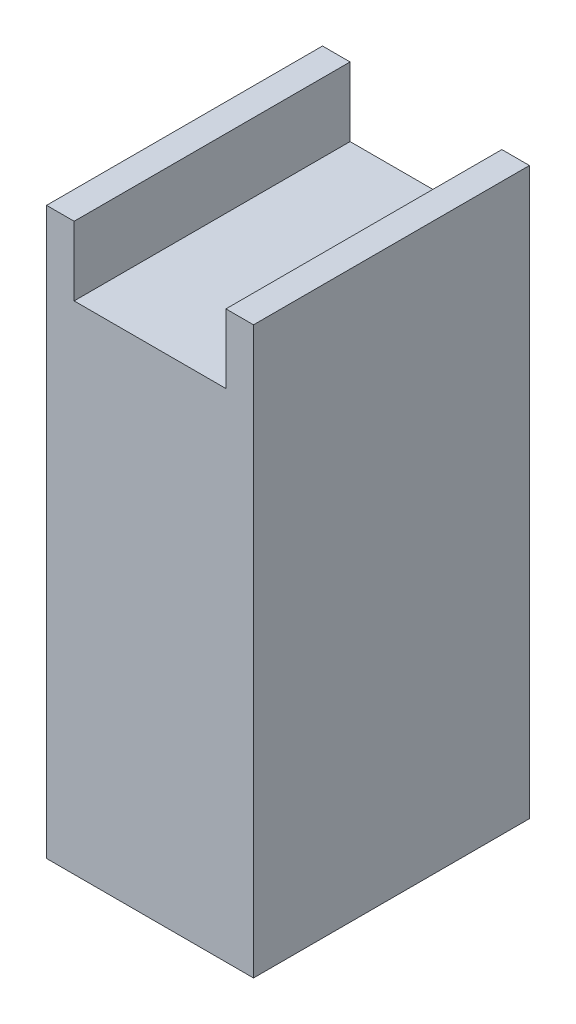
SolidWorks part; units mm, degrees
ref_plane "Front Plane" through (0, 0, 0) normal (0, 0, 1) x (1, 0, 0)
ref_plane "Top Plane" through (0, 0, 0) normal (0, 1, 0) x (1, 0, 0)
ref_plane "Right Plane" through (0, 0, 0) normal (1, 0, 0) x (0, 0, -1)
sketch "Sketch1" plane through (0, 0, 0) normal (0, 0, 1) x (1, 0, 0)
  line L0 (-9.525, 0) -> (-9.525, 52.07)
  line L1 (-9.525, 52.07) -> (-6.985, 52.07)
  line L2 (-6.985, 52.07) -> (-6.985, 45.72)
  line L3 (-6.985, 45.72) -> (6.985, 45.72)
  line L4 (-9.525, 0) -> (9.525, 0)
  line L5 (0, 0) -> (0, 45.72) construction
  line L6 (6.985, 52.07) -> (6.985, 45.72)
  line L7 (9.525, 52.07) -> (6.985, 52.07)
  line L8 (9.525, 0) -> (9.525, 52.07)
  dimension "D1" = 19.05
  dimension "D2" = 13.97
  dimension "D3" = 45.72
  dimension "D4" = 6.35
extrude "Boss-Extrude1" add sketch "Sketch1" along normal blind 25.4
